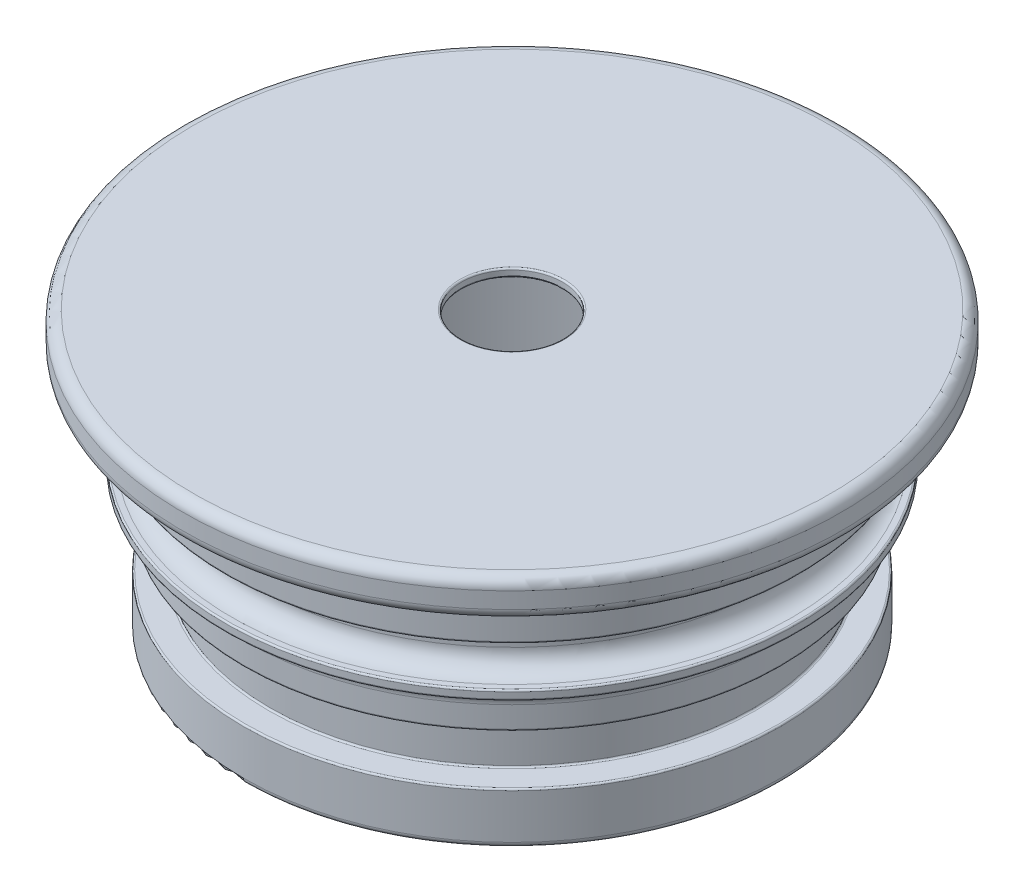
SolidWorks part; units mm, degrees
ref_plane "Front Plane" through (0, 0, 0) normal (0, 0, 1) x (1, 0, 0)
ref_plane "Top Plane" through (0, 0, 0) normal (0, 1, 0) x (1, 0, 0)
ref_plane "Right Plane" through (0, 0, 0) normal (1, 0, 0) x (0, 0, -1)
sketch "Sketch1" plane through (0, 0, 0) normal (0, 0, 1) x (1, 0, 0)
  line L0 (0, 0) -> (0, -13.8562) construction
  line L1 (-2.4638, 0) -> (-15.0495, 0)
  line L2 (-15.5575, -0.508) -> (-15.5575, -1.27)
  line L3 (-15.0495, -1.778) -> (-13.6144, -1.778)
  line L4 (-13.5382, -1.8542) -> (-13.5382, -4.0132)
  line L5 (-12.3952, -4.0894) -> (-13.462, -4.0894)
  line L6 (-12.319, -4.1656) -> (-12.319, -5.1054)
  line L7 (-13.208, -5.9944) -> (-13.462, -5.9944)
  line L8 (-12.6746, -8.2042) -> (-12.6746, -7.1986)
  line L9 (-13.462, -6.4366) -> (-13.4366, -6.4366)
  line L10 (-13.5382, -6.3604) -> (-13.5382, -6.0706)
  line L11 (-12.5984, -8.2804) -> (-11.5062, -8.2804)
  line L12 (-11.43, -8.3566) -> (-11.43, -10.5664)
  line L13 (-11.5062, -10.6426) -> (-12.5984, -10.6426)
  line L14 (-12.6746, -10.7188) -> (-12.6746, -12.827)
  line L15 (-12.4206, -13.081) -> (-10.6172, -13.081)
  line L16 (-10.541, -13.0048) -> (-10.541, -2.8843)
  line L17 (-9.4915, -1.6336) -> (-2.4506, -0.3921)
  line L18 (-2.3876, -0.3171) -> (-2.3876, -0.0762)
  arc A0 (-12.319, -5.1054) -> (-13.208, -5.9944) centre (-13.208, -5.1054) cw
  arc A1 (-10.541, -2.8843) -> (-9.4915, -1.6336) centre (-9.271, -2.8843) cw
  arc A2 (-13.462, -4.0894) -> (-13.5382, -4.0132) centre (-13.462, -4.0132) cw
  arc A3 (-15.0495, 0) -> (-15.5575, -0.508) centre (-15.0495, -0.508) ccw
  arc A4 (-15.5575, -1.27) -> (-15.0495, -1.778) centre (-15.0495, -1.27) ccw
  arc A5 (-2.3876, -0.0762) -> (-2.4638, 0) centre (-2.4638, -0.0762) ccw
  arc A6 (-2.4506, -0.3921) -> (-2.3876, -0.3171) centre (-2.4638, -0.3171) ccw
  arc A8 (-12.3952, -4.0894) -> (-12.319, -4.1656) centre (-12.3952, -4.1656) cw
  arc A9 (-13.462, -5.9944) -> (-13.5382, -6.0706) centre (-13.462, -6.0706) ccw
  arc A10 (-13.4366, -6.4366) -> (-12.6746, -7.1986) centre (-13.4366, -7.1986) cw
  arc A11 (-11.43, -10.5664) -> (-11.5062, -10.6426) centre (-11.5062, -10.5664) cw
  arc A12 (-12.5984, -10.6426) -> (-12.6746, -10.7188) centre (-12.5984, -10.7188) ccw
  arc A13 (-12.6746, -12.827) -> (-12.4206, -13.081) centre (-12.4206, -12.827) ccw
  arc A14 (-10.541, -13.0048) -> (-10.6172, -13.081) centre (-10.6172, -13.0048) cw
  arc A15 (-11.5062, -8.2804) -> (-11.43, -8.3566) centre (-11.5062, -8.3566) cw
  arc A16 (-12.6746, -8.2042) -> (-12.5984, -8.2804) centre (-12.5984, -8.2042) ccw
  arc A17 (-13.5382, -6.3604) -> (-13.462, -6.4366) centre (-13.462, -6.3604) ccw
  arc A18 (-13.6144, -1.778) -> (-13.5382, -1.8542) centre (-13.6144, -1.8542) cw
  point P20 (-12.319, -5.9944)
  point P34 (-2.3876, 0)
  point P37 (-2.3876, -0.381)
  dimension "D5" = 0.889
  dimension "D12" = 1.27
  dimension "D20" = 3.3274
  dimension "D23" = 0.508
  dimension "D24" = 0.0762
  dimension "D18" = 0.762
  dimension "D21" = 0.254
  dimension "D11" = 2.3114
  dimension "D1" = 27.0764
  dimension "D4" = 24.638
  dimension "D6" = 2.4384
  dimension "D7" = 22.86
  dimension "D8" = 8.2804
  dimension "D9" = 2.3622
  dimension "D10" = 25.3492
  dimension "D13" = 10
  dimension "D14" = 0.381
  dimension "D15" = 21.082
  dimension "D16" = 4.7752
  dimension "D17" = 31.115
  dimension "D19" = 1.778
  dimension "D31" = 1.2042
revolve "Revolve1" add sketch "Sketch1" angle 360 about L0
